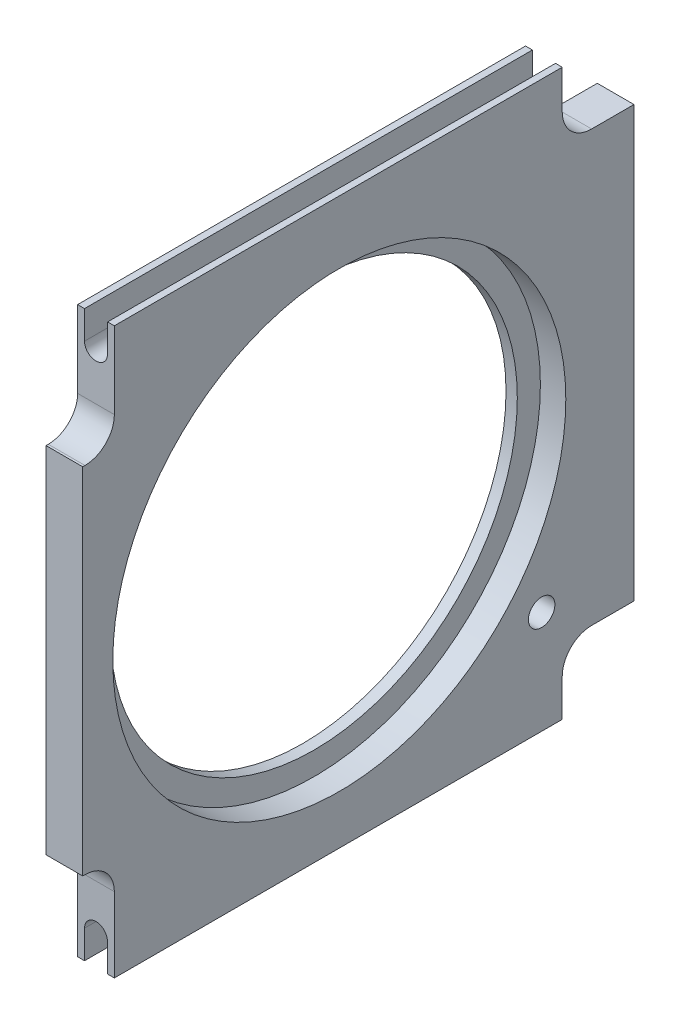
SolidWorks part; units mm, degrees
ref_plane "Plane1" through (0, 0, 0) normal (0, 0, 1) x (1, 0, 0)
ref_plane "Plane2" through (0, 0, 0) normal (0, 1, 0) x (1, 0, 0)
ref_plane "Plane3" through (0, 0, 0) normal (1, 0, 0) x (0, 0, -1)
sketch "Sketch1" plane through (0, 0, 0) normal (1, 0, 0) x (0, 0, -1)
  line L0 (66.258, 65.0522) -> (66.258, -61.9478)
  line L1 (-57.186, 41.1572) -> (-57.694, 41.1572)
  line L2 (-57.694, 41.1572) -> (-57.694, -38.5286)
  line L3 (-50.582, 65.0522) -> (66.258, 65.0522)
  line L5 (-50.582, 65.0522) -> (-50.582, 47.7612)
  line L6 (-50.582, -61.9478) -> (66.258, -61.9478)
  line L8 (-57.694, -38.5286) -> (-57.186, -38.5286)
  line L9 (-50.582, -45.1326) -> (-50.582, -61.9478)
  circle A0 centre (0, 0) radius 45.7376
  circle A1 centre (45.4889, -38.762) radius 2.9764
  arc A2 (-57.186, 41.1572) -> (-50.582, 47.7612) centre (-57.186, 47.7612) ccw
  arc A3 (-57.186, -38.5286) -> (-50.582, -45.1326) centre (-57.186, -45.1326) cw
  dimension "D1" = 6.604
  dimension "D4" = 6.604
  dimension "D3" = 116.84
extrude "Part outline" add sketch "Sketch1" along normal blind 8.255
sketch "Sketch3" plane through (0, 0, -66.258) normal (0, 0, -1) x (-1, 0, 0)
  line L0 (-1.5478, 58.7022) -> (-1.5478, 68.6037)
  line L1 (-6.7627, 68.6037) -> (-1.5478, 68.6037)
  line L2 (-8.255, 0.0128) -> (27.989, 0.0128) construction
  line L3 (-6.7627, 68.6037) -> (-6.7071, 58.7287)
  line L4 (-1.5478, -55.5978) -> (-1.5478, -67.236)
  line L5 (-1.5478, -67.236) -> (-6.7072, -67.236)
  line L6 (-6.7072, -55.5978) -> (-6.7072, -67.236)
  arc A0 (-1.5478, -55.5978) -> (-6.7072, -55.5978) centre (-4.1275, -55.5978) ccw
  arc A2 (-6.7071, 58.7287) -> (-1.5478, 58.7022) centre (-4.1275, 58.7022) ccw
  dimension "D2" = 5.1594
  dimension "D4" = 5.1594
sketch "Sketch2" plane through (8.255, 0, 0) normal (1, 0, 0) x (0, 0, -1)
  circle A0 centre (0, 0) radius 50.927
  dimension "D1" = 101.854
extrude "Cow paddy cutout" cut sketch "Sketch2" against normal blind 5.715 and the other way blind 25.4
extrude "Bolt slots" cut sketch "Sketch3" against normal through all
sketch "Sketch4" plane through (8.255, 0, 0) normal (1, 0, 0) x (0, 0, -1)
  line L0 (56.727, 49.7212) -> (73.4065, 49.7212)
  line L1 (50.123, 71.5192) -> (73.4065, 71.5192)
  line L2 (50.123, 71.5192) -> (50.123, 56.3252)
  line L3 (50.123, -77.4423) -> (73.4065, -77.4423)
  line L4 (73.4065, 71.5192) -> (73.4065, 49.7212)
  line L5 (56.727, -46.9574) -> (73.4065, -46.9574)
  line L6 (73.4065, -46.9574) -> (73.4065, -77.4423)
  line L7 (50.123, -53.5614) -> (50.123, -77.4423)
  arc A0 (50.123, 56.3252) -> (56.727, 49.7212) centre (56.727, 56.3252) ccw
  arc A1 (50.123, -53.5614) -> (56.727, -46.9574) centre (56.727, -53.5614) cw
  point P12 (50.123, -46.9574)
  dimension "D1" = 6.604
  dimension "D2" = 6.604
extrude "Bolt countersinks" cut sketch "Sketch4" against normal through all
